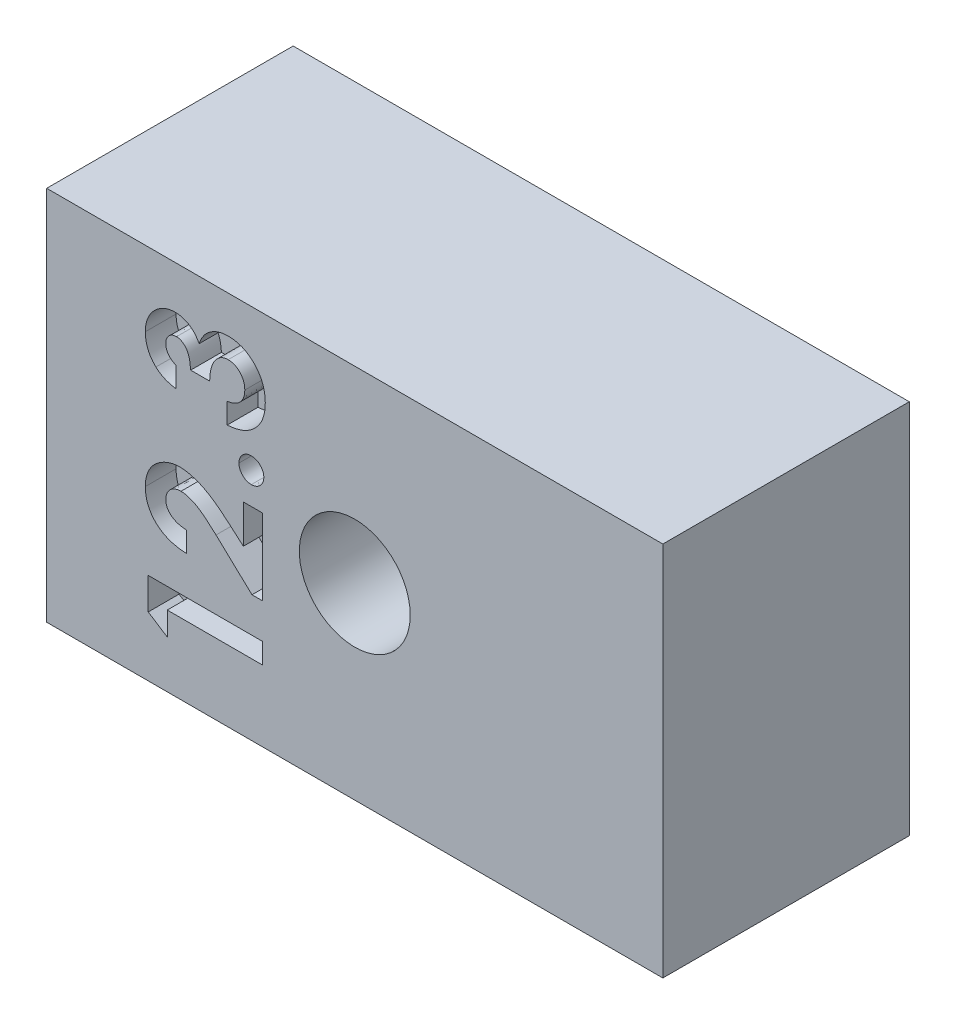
SolidWorks part; units mm, degrees
ref_plane "Front Plane" through (0, 0, 0) normal (0, 0, 1) x (1, 0, 0)
ref_plane "Top Plane" through (0, 0, 0) normal (0, 1, 0) x (1, 0, 0)
ref_plane "Right Plane" through (0, 0, 0) normal (1, 0, 0) x (0, 0, -1)
sketch "Sketch1" plane through (0, 0, 0) normal (0, 0, 1) x (1, 0, 0)
  line L1 (-12.2454, 6.5291) -> (7.7546, 6.5291)
  line L2 (-12.2454, 6.5291) -> (-12.2454, -5.6709)
  line L3 (-12.2454, -5.6709) -> (7.7546, -5.6709)
  line L4 (7.7546, 6.5291) -> (7.7546, -5.6709)
  circle A0 centre (-2.2454, 0.4291) radius 1.8
  point P6 (0, 0)
  point P7 (-12.2454, 0.4291)
  dimension "D3" = 3.6
  dimension "D1" = 12.2
  dimension "D2" = 20
  dimension "D4" = 10
extrude "Boss-Extrude1" add sketch "Sketch1" along normal blind 8
ref_plane "Plane1" through (0, 0, 8) normal (0, 0, 1) x (1, 0, 0)
sketch "Sketch3" plane through (0, 0, 8) normal (0, 0, 1) x (1, 0, 0)
  line L0 (-5.2454, -5.6709) -> (-5.2454, 6.5291) construction
  line L1 (-12.2454, -5.6709) -> (7.7546, -5.6709) construction
  line L2 (7.7546, 6.5291) -> (-12.2454, 6.5291) construction
  line L3 (7.7546, -5.6709) -> (7.7546, 6.5291) construction
  text T0 "12.3  " font "Century Gothic" height in points 14
  dimension "D1" = 13
extrude "Cut-Extrude1" cut sketch "Sketch3" against normal blind 1
